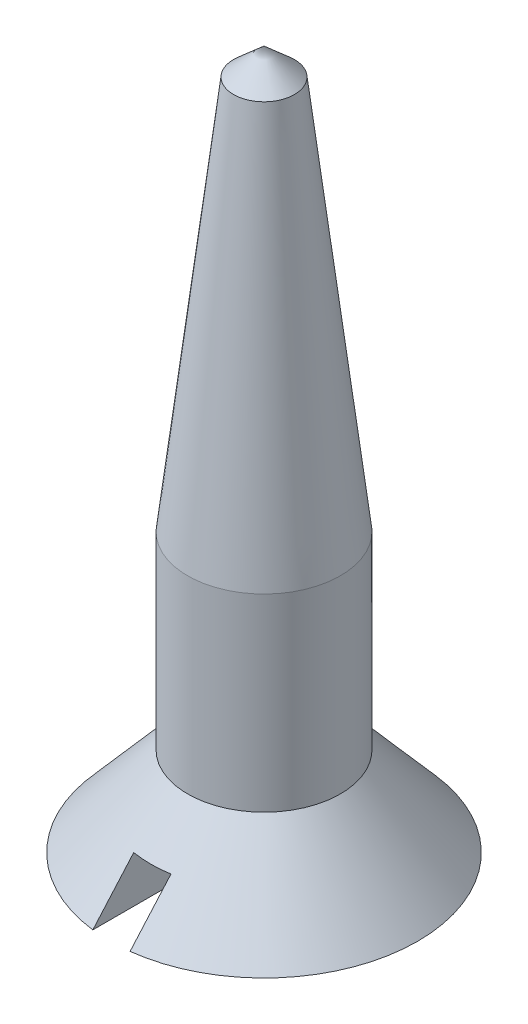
SolidWorks part; units mm, degrees
ref_plane "Front Plane" through (0, 0, 0) normal (0, 0, 1) x (1, 0, 0)
ref_plane "Top Plane" through (0, 0, 0) normal (0, 1, 0) x (1, 0, 0)
ref_plane "Right Plane" through (0, 0, 0) normal (1, 0, 0) x (0, 0, -1)
sketch "Sketch1" plane through (0, 0, 0) normal (0, 0, 1) x (1, 0, 0)
  line L0 (0, 0) -> (0, 19.05)
  line L2 (-2.0828, 7.5784) -> (-2.0828, 2.4252)
  line L3 (-2.0828, 2.4252) -> (-4.191, 0)
  line L4 (-4.191, 0) -> (0, 0)
  line L5 (0, 0) -> (0, 27.4996) construction
  line L7 (-2.0828, 7.5784) -> (-0.8296, 18.3181)
  line L8 (-0.8296, 18.3181) -> (0, 19.05)
  point P4 (-2.0828, 19.05)
  dimension "D1" = 19.05
  dimension "D2" = 4.1656
  dimension "D3" = 8.382
  dimension "D4" = 41
revolve "Revolve1" add sketch "Sketch1" angle 360 about L5
sketch "Sketch4" plane through (0, 0, 0) normal (0, 0, 1) x (1, 0, 0)
  line L1 (-0.508, -1.27) -> (0.508, -1.27)
  line L2 (-0.508, -1.27) -> (-0.508, 1.27)
  line L3 (-0.508, 1.27) -> (0.508, 1.27)
  line L4 (0.508, -1.27) -> (0.508, 1.27)
  line L5 (-0.508, -1.27) -> (0.508, 1.27) construction
  line L6 (-0.508, 1.27) -> (0.508, -1.27) construction
  point P0 (0, 0)
  dimension "D1" = 1.016
  dimension "D2" = 2.54
extrude "Cut-Extrude1" cut sketch "Sketch4" against normal through all both and the other way through all
